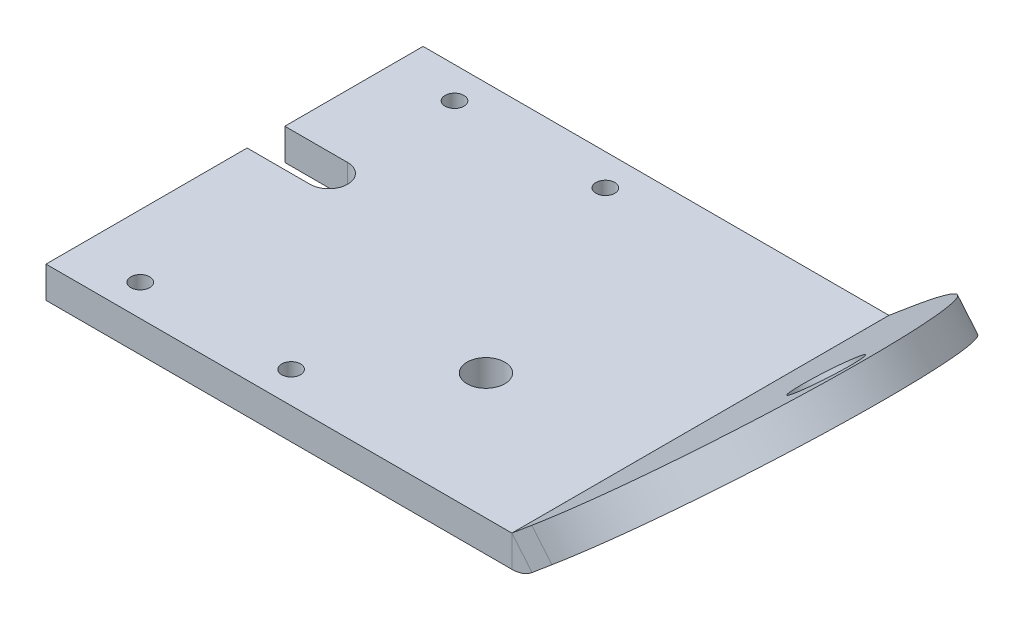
SolidWorks part; units mm, degrees
ref_plane "Front" through (0, 0, 0) normal (0, 0, 1) x (1, 0, 0)
ref_plane "Top" through (0, 0, 0) normal (0, 1, 0) x (1, 0, 0)
ref_plane "Right" through (0, 0, 0) normal (1, 0, 0) x (0, 0, -1)
sketch "Sketch1" plane through (0, 0, 0) normal (0, 1, 0) x (1, 0, 0)
  line L1 (0, 0) -> (80, 0)
  line L2 (0, 0) -> (0, 32)
  line L3 (0, 60) -> (80, 60)
  line L6 (0, 38) -> (0, 60)
  line L11 (0, 38) -> (10, 38)
  line L12 (0, 32) -> (10, 32)
  circle A0 centre (10, 55) radius 1.5
  circle A1 centre (34, 55) radius 1.5
  circle A2 centre (10, 5) radius 1.5
  circle A3 centre (34, 5) radius 1.5
  arc A4 (10, 32) -> (10, 38) centre (10, 35) ccw
  arc A6 (80, 0) -> (80, 60) centre (80, 30) ccw
  circle A7 centre (102, 30) radius 5
  circle A8 centre (50, 20) radius 3
sheet metal parameters "Sheet-Metal1" thickness 5 parameters "D1"=0.01
base flange "Base-Flange1" sketch "Sketch1" thickness 5 reverse thickness direction yes parameters "D1"=0.01
sketch "Sketch3" plane through (0, 5, 0) normal (0, 1, 0) x (-1, 0, 0)
  line L1 (-75, 0) -> (-75, -60)
sketched bend "Sketched Bend1" parameters "D1"=0.01
bend "SketchBend1" bend radius 0.01 bend angle 40 parameters "D5"=1
flat pattern "Flat-Pattern1"
sketch "Bend-Lines1" plane through (0, 5, 0) normal (0, 1, 0) x (-1, 0, 0)
  line L0 (-75, -60) -> (-75, 0) construction
bend of the flat pattern "Flatten-<SketchBend1>1"
